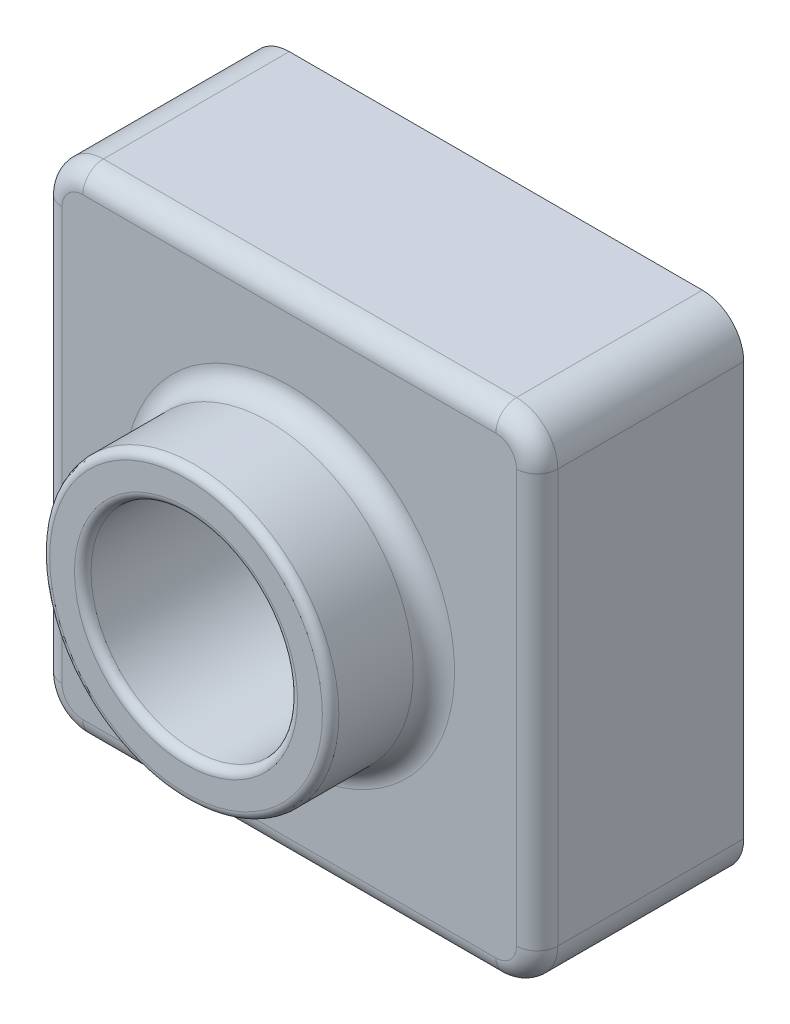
SolidWorks part; units mm, degrees
ref_plane "Front Plane" through (0, 0, 0) normal (0, 0, 1) x (1, 0, 0)
ref_plane "Top Plane" through (0, 0, 0) normal (0, 1, 0) x (1, 0, 0)
ref_plane "Right Plane" through (0, 0, 0) normal (1, 0, 0) x (0, 0, -1)
sketch "Sketch1" plane through (0, 0, 0) normal (0, 0, 1) x (1, 0, 0)
  line L1 (0, 0) -> (120, 0)
  line L2 (0, 0) -> (0, 120)
  line L3 (0, 120) -> (120, 120)
  line L4 (120, 0) -> (120, 120)
  dimension "D1" = 120
  dimension "D2" = 120
extrude "Extrude1" add sketch "Sketch1" along normal blind 50
sketch "Sketch2" plane through (0, 0, 50) normal (0, 0, 1) x (1, 0, 0)
  line L0 (120, 120) -> (0, 120) construction
  line L1 (120, 0) -> (120, 120) construction
  circle A0 centre (60, 60) radius 35
  dimension "D3" = 70
  dimension "D1" = 60
  dimension "D2" = 60
extrude "Extrude2" add sketch "Sketch2" along normal blind 25
sketch "Sketch3" plane through (0, 0, 75) normal (0, 0, 1) x (1, 0, 0)
  circle A0 centre (60, 60) radius 25
  circle A1 centre (60, 60) radius 35 construction
  dimension "D1" = 50
extrude "Cut-Extrude1" cut sketch "Sketch3" against normal through all
fillet "Fillet1" radius 10 4 edges at (120, 120, 25) (120, 0, 25) (0, 0, 25) (0, 120, 25)
fillet "Fillet2" radius 5 9 edges at (25, 60, 50) (117.0711, 2.9289, 50) (60, 0, 50) (2.9289, 2.9289, 50) (0, 60, 50) (2.9289, 117.0711, 50) (60, 120, 50) (117.0711, 117.0711, 50) (120, 60, 50)
fillet "Fillet3" radius 2 2 edges at (95, 60, 75) (85, 60, 75)
shell "Shell1" thickness 2
